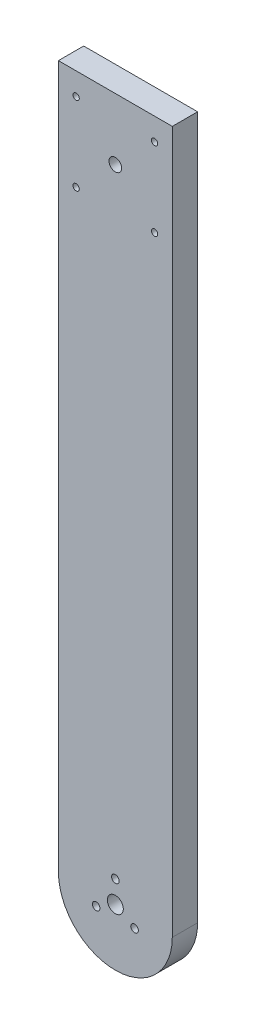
SolidWorks part; units mm, degrees
ref_plane "Front Plane" through (0, 0, 0) normal (0, 0, 1) x (1, 0, 0)
ref_plane "Top Plane" through (0, 0, 0) normal (0, 1, 0) x (1, 0, 0)
ref_plane "Right Plane" through (0, 0, 0) normal (1, 0, 0) x (0, 0, -1)
sketch "Sketch1" plane through (0, 0, 0) normal (0, 0, 1) x (1, 0, 0)
  line L0 (0, -1565.9861) -> (0, 76733.3209) construction
  line L1 (-22.5, 130) -> (22.5, 130)
  line L2 (-22.5, 130) -> (-22.5, -147.5)
  line L4 (22.5, 130) -> (22.5, -147.5)
  line L5 (-22.5, 130) -> (29.4093, -169.9204) construction
  line L6 (-22.5, -130) -> (22.5, 130) construction
  line L7 (-1565.9861, 0) -> (76733.3209, 0) construction
  line L8 (-42.7696, 105.6639) -> (42.7696, 105.6639) construction
  line L9 (-21.1, 126.7639) -> (21.1, 126.7639) construction
  line L10 (-21.1, 126.7639) -> (-21.1, 84.5639) construction
  line L11 (-21.1, 84.5639) -> (21.1, 84.5639) construction
  line L12 (21.1, 126.7639) -> (21.1, 84.5639) construction
  line L13 (-21.1, 126.7639) -> (21.1, 84.5639) construction
  line L14 (-21.1, 84.5639) -> (21.1, 126.7639) construction
  circle A0 centre (-15.5, 121.1639) radius 1.25
  circle A1 centre (15.5, 121.1639) radius 1.25
  circle A2 centre (15.5, 90.1639) radius 1.25
  circle A3 centre (-15.5, 90.1639) radius 1.25
  circle A4 centre (0, 105.6639) radius 2.5
  circle A5 centre (0, -147.5) radius 8.75 construction
  arc A6 (-22.5, -147.5) -> (22.5, -147.5) centre (0, -147.5) ccw
  circle A7 centre (0, -138.75) radius 1.5
  circle A8 centre (7.5777, -151.875) radius 1.5
  circle A9 centre (-7.5777, -151.875) radius 1.5
  circle A10 centre (0, -147.5) radius 3.15
  point P0 (0, 0)
  point P9 (0, 105.6639)
  point P20 (0, 105.6639)
  point P28 (0, 83.0234)
  point P40 (0, -170)
  point P46 (0, -107.5)
  point P49 (0, -147.5)
  dimension "D4" = 2.5
  dimension "D6" = 5
  dimension "D9" = 17.5
  dimension "D10" = 3
  dimension "D12" = 6.3
  dimension "D1" = 45
  dimension "D2" = 300
  dimension "D3" = 42.2
  dimension "D5" = 31
  dimension "D11" = 3
extrude "Boss-Extrude1" add sketch "Sketch1" along normal blind 10
